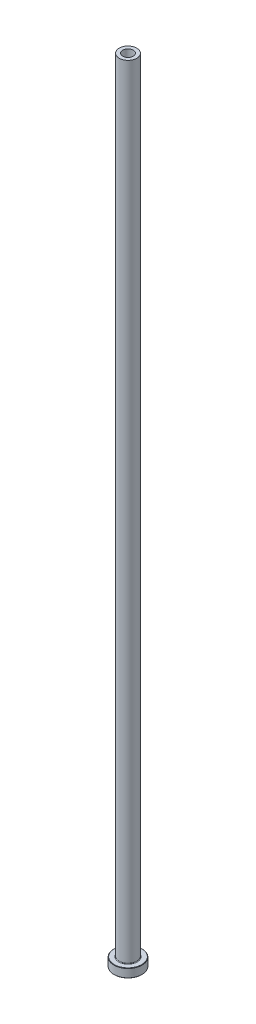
SolidWorks part; units mm, degrees
ref_plane "Front Plane" through (0, 0, 0) normal (0, 0, 1) x (1, 0, 0)
ref_plane "Top Plane" through (0, 0, 0) normal (0, 1, 0) x (1, 0, 0)
ref_plane "Right Plane" through (0, 0, 0) normal (1, 0, 0) x (0, 0, -1)
sketch "Sketch1" plane through (0, 0, 0) normal (0, 0, 1) x (1, 0, 0)
  line L0 (-3, 450) -> (-5, 450)
  line L1 (-5, 450) -> (-5, 5)
  line L2 (-5, 5) -> (-8, 5)
  line L3 (-8, 5) -> (-8, 0)
  line L4 (8.8, 0) -> (-8.8, 0) construction
  line L5 (-8, 0) -> (-3.25, 0)
  line L6 (-3, 405) -> (-3, 450)
  line L7 (0, 92.1877) -> (0, -15.5353) construction
  line L8 (0, -8.8) -> (0, 8.8) construction
  line L9 (-3, 405) -> (-3.25, 393)
  line L10 (-3.25, 393) -> (-3.25, 0)
  dimension "D1" = 0.25
  dimension "ID" = 6
  dimension "OD" = 10
  dimension "L" = 450
  dimension "H" = 16
  dimension "T" = 5
  dimension "N" = 45
  dimension "D2" = 12
revolve "Revolve1" add sketch "Sketch1" angle 360 about L7
fillet "Fillet1" radius 0.3 1 edges at (0, 5, 5)
chamfer "Chamfer1" distance 0.2 angle 45 2 edges at (0, 5, 8) (0, 0, 8)
chamfer "Chamfer3" distance 0.5 angle 45 1 edges at (0, 0, 3.25)
